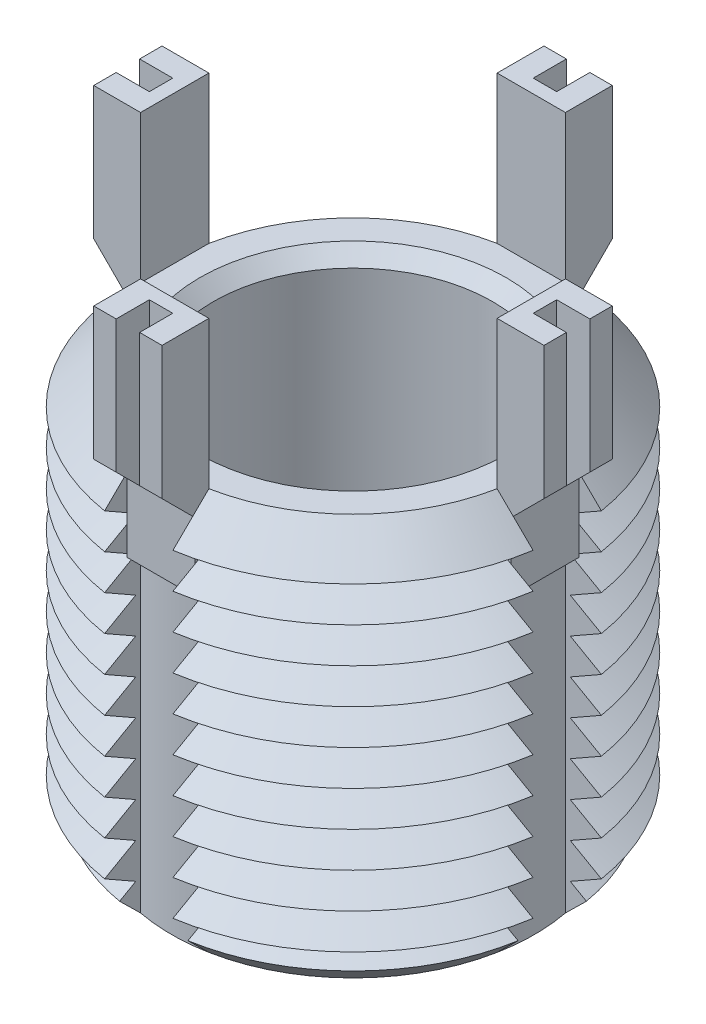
SolidWorks part; units mm, degrees
ref_plane "Front Plane" through (0, 0, 0) normal (0, 0, 1) x (1, 0, 0)
ref_plane "Top Plane" through (0, 0, 0) normal (0, 1, 0) x (1, 0, 0)
ref_plane "Right Plane" through (0, 0, 0) normal (1, 0, 0) x (0, 0, -1)
sketch "Sketch1" plane through (0, 0, 0) normal (0, 1, 0) x (1, 0, 0)
  circle A0 centre (0, 0) radius 11.1125
  dimension "D1" = 22.225
extrude "Boss-Extrude1" add sketch "Sketch1" against normal blind 20.574
chamfer "Chamfer1" distance 1.814 angle 45 2 edges at (0, -20.574, 11.1125) (0, 0, 11.1125)
sketch "Sketch2" plane through (0, 0, 0) normal (1, 0, 0) x (0, 0, -1)
  line L0 (0, 0.8859) -> (0, -9.2617) construction
sketch "Sketch3" plane through (0, 0, 0) normal (1, 0, 0) x (0, 0, -1)
  line L0 (-11.1125, -1.814) -> (-9.5415, -2.721)
  line L1 (-9.5415, -2.721) -> (-11.1125, -3.628)
  line L2 (-11.1125, -1.814) -> (-11.1125, -18.76) construction
  line L3 (-11.1125, -3.628) -> (-11.1125, -1.814)
  dimension "D1" = 1.814
revolve "Cut-Revolve1" cut sketch "Sketch3" angle 360 about L0
pattern_linear "LPattern1" count 10 spacing 1.814 along (0, -1, 0) of "Cut-Revolve1"
sketch "Sketch4" plane through (0, 0, 0) normal (0, 1, 0) x (1, 0, 0)
  line L0 (-9.1323, 1.75) -> (-10.9738, 1.75)
  line L2 (-10.9738, -1.75) -> (-9.1323, -1.75)
  arc A0 (-9.1323, 1.75) -> (-9.1323, -1.75) centre (0, 0) ccw
  arc A1 (-10.9738, 1.75) -> (-10.9738, -1.75) centre (0, 0) ccw
  circle A2 centre (0, 0) radius 11.1125 construction
  circle A3 centre (0, 0) radius 9.2985 construction
  point P1 (-9.2985, 0)
  point P3 (-11.1125, 0)
  point P13 (0, 0)
  dimension "D1" = 3.5
extrude "Cut-Extrude1" cut sketch "Sketch4" against normal up to surface (20.574 mm away)
pattern_circular "CirPattern1" count 4 over 360 about axis through (0, 0, 0) along (0, 1, 0) of "Cut-Extrude1"
sketch "Sketch5" plane through (0, 0, 0) normal (1, 0, 0) x (0, 0, -1)
  line L0 (-9.1323, 7.558) -> (-9.1323, -4.442)
  line L1 (-9.1323, -4.442) -> (-9.8323, -4.442)
  line L2 (-9.8323, -4.442) -> (-9.8323, -0.942)
  line L3 (-9.8323, -0.942) -> (-11.5323, 0.758)
  line L4 (-11.5323, 0.758) -> (-11.5323, 7.558)
  line L5 (-11.5323, 7.558) -> (-9.1323, 7.558)
  line L6 (-10.9738, -5.442) -> (-1.75, -5.442) construction
  point P9 (-1.75, 0)
  point P10 (-9.8323, -0.942)
  dimension "D1" = 1
  dimension "D2" = 12
  dimension "D3" = 8.5
  dimension "D4" = 2.4
  dimension "D5" = 0.7
  dimension "D6" = 45
extrude "Boss-Extrude3" add sketch "Sketch5" along normal mid plane 3.5
pattern_circular "CirPattern2" count 4 over 360 about axis through (0, 0, 0) along (0, 1, 0) of "Boss-Extrude3"
sketch "Sketch6" plane through (0, 7.558, 0) normal (0, 1, 0) x (1, 0, 0)
  line L0 (-11.5323, -1.75) -> (-11.5323, 1.75) construction
  line L1 (-11.5323, -0.6) -> (-9.8323, -0.6)
  line L2 (-11.5323, -0.6) -> (-11.5323, 0.6)
  line L3 (-11.5323, 0.6) -> (-9.8323, 0.6)
  line L4 (-9.8323, -0.6) -> (-9.8323, 0.6)
  line L5 (-11.5323, -0.6) -> (-9.8323, 0.6) construction
  line L6 (-11.5323, 0.6) -> (-9.8323, -0.6) construction
  line L7 (11.5323, 1.75) -> (11.5323, -1.75) construction
  line L8 (-0.6, 9.8323) -> (0.6, 9.8323)
  line L9 (-0.6, 9.8323) -> (-0.6, 11.5323)
  line L10 (-0.6, 11.5323) -> (0.6, 11.5323)
  line L11 (0.6, 9.8323) -> (0.6, 11.5323)
  line L12 (-0.6, 9.8323) -> (0.6, 11.5323) construction
  line L13 (-0.6, 11.5323) -> (0.6, 9.8323) construction
  line L14 (9.8323, -0.6) -> (11.5323, -0.6)
  line L15 (9.8323, -0.6) -> (9.8323, 0.6)
  line L16 (9.8323, 0.6) -> (11.5323, 0.6)
  line L17 (11.5323, -0.6) -> (11.5323, 0.6)
  line L18 (9.8323, -0.6) -> (11.5323, 0.6) construction
  line L19 (9.8323, 0.6) -> (11.5323, -0.6) construction
  line L20 (-0.6, -11.5323) -> (0.6, -11.5323)
  line L21 (-0.6, -11.5323) -> (-0.6, -9.8323)
  line L22 (-0.6, -9.8323) -> (0.6, -9.8323)
  line L23 (0.6, -11.5323) -> (0.6, -9.8323)
  line L24 (-0.6, -11.5323) -> (0.6, -9.8323) construction
  line L25 (-0.6, -9.8323) -> (0.6, -11.5323) construction
  line L26 (-1.75, 11.5323) -> (1.75, 11.5323) construction
  line L27 (1.75, -11.5323) -> (-1.75, -11.5323) construction
  point P0 (-10.6823, 0)
  point P7 (-11.5323, 0)
  point P8 (-11.5323, 0)
  point P9 (0, 10.6823)
  point P14 (10.6823, 0)
  point P19 (0, -10.6823)
  point P24 (0, 11.5323)
  point P25 (11.5323, 0)
  point P26 (11.5323, 0)
  point P27 (0, 11.5323)
  point P30 (0, -11.5323)
  point P33 (0, -11.5323)
  dimension "D1" = 1.2
  dimension "D2" = 1.7
extrude "Cut-Extrude3" cut sketch "Sketch6" against normal through all both and the other way through all
sketch "Sketch7" plane through (0, 0, 0) normal (0, 1, 0) x (1, 0, 0)
  circle A0 centre (0, 0) radius 7.144
  dimension "D1" = 14.288
extrude "Cut-Extrude4" cut sketch "Sketch7" against normal up to surface (20.574 mm away)
chamfer "Chamfer2" distance 0.7055 angle 45 2 edges at (0, 0, 7.144) (0, -20.574, 7.144)
